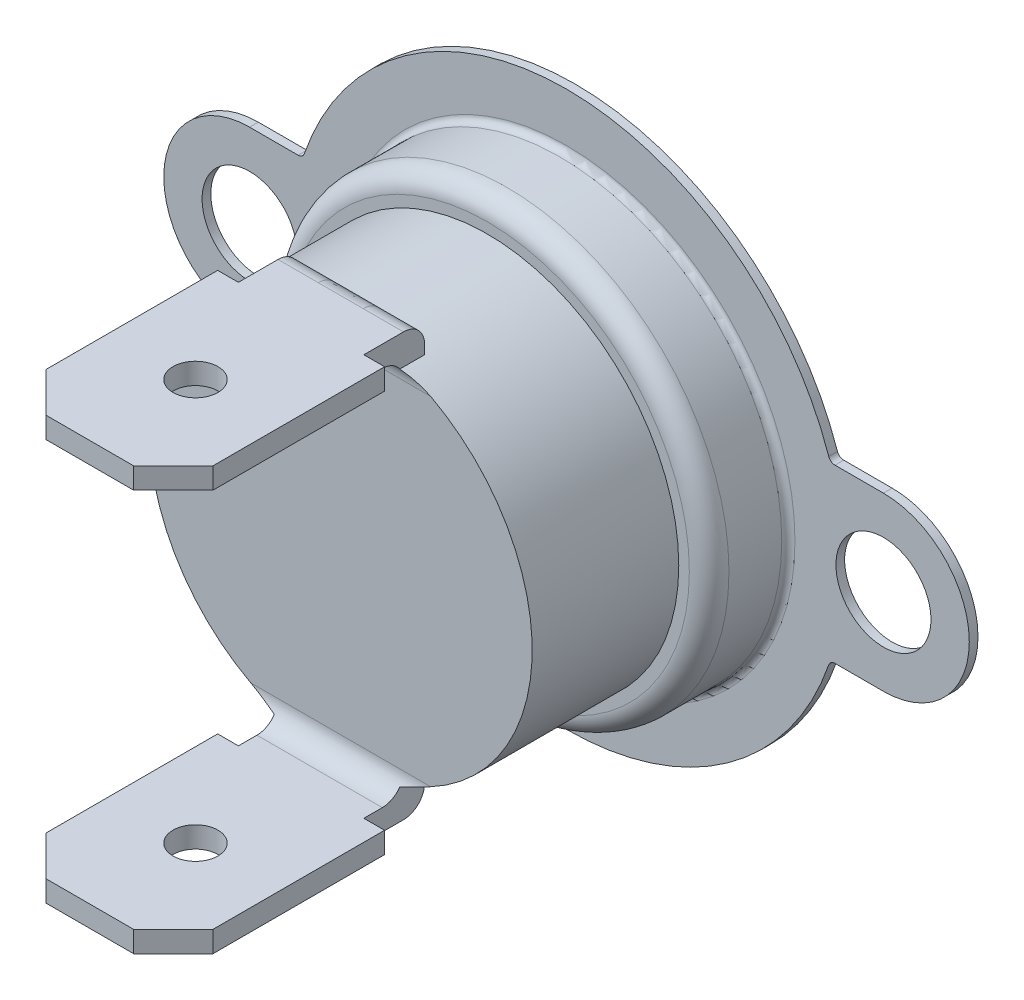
SolidWorks part; units mm, degrees
ref_plane "Plan de face" through (0, 0, 0) normal (0, 0, 1) x (1, 0, 0)
ref_plane "Plan de dessus" through (0, 0, 0) normal (0, 1, 0) x (1, 0, 0)
ref_plane "Plan de droite" through (0, 0, 0) normal (1, 0, 0) x (0, 0, -1)
sketch "Esquisse1" plane through (0, 0, 0) normal (0, 0, 1) x (1, 0, 0)
  line L0 (-12, 3.25) -> (-9.9844, 3.25)
  line L1 (-12, -3.25) -> (-9.9844, -3.25)
  line L2 (12, 3.25) -> (9.9844, 3.25)
  line L3 (12, -3.25) -> (9.9844, -3.25)
  arc A0 (-9.9844, -3.25) -> (9.9844, -3.25) centre (0, 0) ccw
  arc A1 (-12, 3.25) -> (-12, -3.25) centre (-12, 0) ccw
  arc A2 (12, -3.25) -> (12, 3.25) centre (12, 0) ccw
  circle A3 centre (-12, 0) radius 1.8
  circle A4 centre (12, 0) radius 1.8
  arc A5 (9.9844, 3.25) -> (-9.9844, 3.25) centre (0, 0) ccw
  dimension "D1" = 21
  dimension "D2" = 6.5
  dimension "D3" = 6.5
  dimension "D4" = 12
  dimension "D5" = 12
extrude "Boss.-Extru.1" add sketch "Esquisse1" along normal blind 0.33
fillet "Congé1" radius 0.25 4 edges at (9.9844, 3.25, 0.165) (9.9844, -3.25, 0.165) (-9.9844, -3.25, 0.165) (-9.9844, 3.25, 0.165)
sketch "Esquisse2" plane through (0, 0, 0.33) normal (0, 0, 1) x (1, 0, 0)
  circle A0 centre (0, 0) radius 8.4
extrude "Boss.-Extru.2" add sketch "Esquisse2" along normal blind 3
sketch "Esquisse3" plane through (0, 0, 3.33) normal (0, 0, 1) x (1, 0, 0)
  circle A0 centre (0, 0) radius 7.25
extrude "Boss.-Extru.3" add sketch "Esquisse3" along normal blind 5.55
fillet "Congé2" radius 0.25 1 edges at (8.4, 0, 0.33)
fillet "Congé3" radius 0.75 1 edges at (8.4, 0, 3.33)
sketch "Esquisse4" plane through (0, 0, 0) normal (0, 1, 0) x (1, 0, 0)
  line L1 (2.375, -8.88) -> (-2.375, -8.88)
  line L3 (2.375, -8.08) -> (-2.375, -8.08)
  line L4 (-2.375, -8.88) -> (-2.375, -8.08)
  line L5 (2.375, -8.88) -> (2.375, -8.08)
  dimension "D2" = 0.8
extrude "Boss.-Extru.4" add sketch "Esquisse4" along normal blind 8 and the other way blind 8
sketch "Esquisse6" plane through (0, 0, 8.88) normal (0, 0, 1) x (1, 0, 0)
  line L1 (-2.375, 8) -> (2.375, 8)
  line L2 (-2.375, 8) -> (-2.375, 7.2)
  line L3 (-2.375, 7.2) -> (2.375, 7.2)
  line L4 (2.375, 8) -> (2.375, 7.2)
  line L6 (-2.375, -8) -> (2.375, -8)
  line L7 (-2.375, -8) -> (-2.375, -7.2)
  line L8 (-2.375, -7.2) -> (2.375, -7.2)
  line L9 (2.375, -8) -> (2.375, -7.2)
  line L10 (2.375, 6.85) -> (2.375, 8) construction
  dimension "D1" = 0.8
  dimension "D2" = 0.8
  dimension "D3" = 0
extrude "Boss.-Extru.5" add sketch "Esquisse6" along normal blind 1.5
sketch "Esquisse7" plane through (0, 0, 10.38) normal (0, 0, 1) x (1, 0, 0)
  line L0 (2.375, 8) -> (-2.375, 8) construction
  line L1 (3.16, 8) -> (-3.16, 8)
  line L2 (3.16, 8) -> (3.16, 7.2)
  line L3 (3.16, 7.2) -> (-3.16, 7.2)
  line L4 (-3.16, 8) -> (-3.16, 7.2)
  line L5 (2.375, -7.2) -> (-2.375, -7.2) construction
  line L6 (-3.16, -7.2) -> (3.16, -7.2)
  line L7 (-3.16, -7.2) -> (-3.16, -8)
  line L8 (-3.16, -8) -> (3.16, -8)
  line L9 (3.16, -7.2) -> (3.16, -8)
  line L10 (-2.375, -8) -> (2.375, -8) construction
  dimension "D1" = 0.8
  dimension "D2" = 6.32
  dimension "D3" = 3.16
  dimension "D4" = 0
  dimension "D5" = 0
  dimension "D6" = 0
extrude "Boss.-Extru.6" add sketch "Esquisse7" along normal blind 8
fillet "Congé4" radius 0.8 4 edges at (0, -7.2, 8.88) (0, 8, 8.08) (0, -8, 8.08)
chamfer "Chanfrein1" distance 1.5 angle 45 4 edges at (-3.16, -7.6, 18.38) (-3.16, 7.6, 18.38) (3.16, -7.6, 18.38) (3.16, 7.6, 18.38)
sketch "Esquisse8" plane through (0, 8, 0) normal (0, 1, 0) x (1, 0, 0)
  line L0 (1.66, -18.38) -> (-1.66, -18.38) construction
  circle A0 centre (0, -14.38) radius 0.85
  dimension "D2" = 1.7
  dimension "D1" = 4
extrude "Enlèv. mat.-Extru.1" cut sketch "Esquisse8" against normal through all
